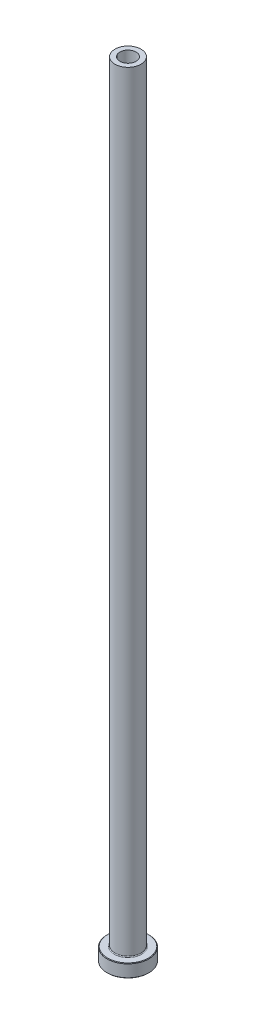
SolidWorks part; units mm, degrees
ref_plane "Front Plane" through (0, 0, 0) normal (0, 0, 1) x (1, 0, 0)
ref_plane "Top Plane" through (0, 0, 0) normal (0, 1, 0) x (1, 0, 0)
ref_plane "Right Plane" through (0, 0, 0) normal (1, 0, 0) x (0, 0, -1)
sketch "Sketch1" plane through (0, 0, 0) normal (0, 0, 1) x (1, 0, 0)
  line L0 (-3.1, 300) -> (-5, 300)
  line L1 (-5, 300) -> (-5, 5)
  line L2 (-5, 5) -> (-8, 5)
  line L3 (-8, 5) -> (-8, 0)
  line L4 (8.8, 0) -> (-8.8, 0) construction
  line L5 (-8, 0) -> (-3.35, 0)
  line L6 (-3.1, 255) -> (-3.1, 300)
  line L7 (0, 92.1877) -> (0, -15.5353) construction
  line L8 (0, -8.8) -> (0, 8.8) construction
  line L9 (-3.1, 255) -> (-3.35, 243)
  line L10 (-3.35, 243) -> (-3.35, 0)
  dimension "D1" = 0.25
  dimension "ID" = 6.2
  dimension "OD" = 10
  dimension "L" = 300
  dimension "H" = 16
  dimension "T" = 5
  dimension "N" = 45
  dimension "D2" = 12
revolve "Revolve1" add sketch "Sketch1" angle 360 about L7
fillet "Fillet1" radius 0.3 1 edges at (0, 5, 5)
chamfer "Chamfer1" distance 0.2 angle 45 2 edges at (0, 5, 8) (0, 0, 8)
chamfer "Chamfer3" distance 0.5 angle 45 1 edges at (0, 0, 3.35)
